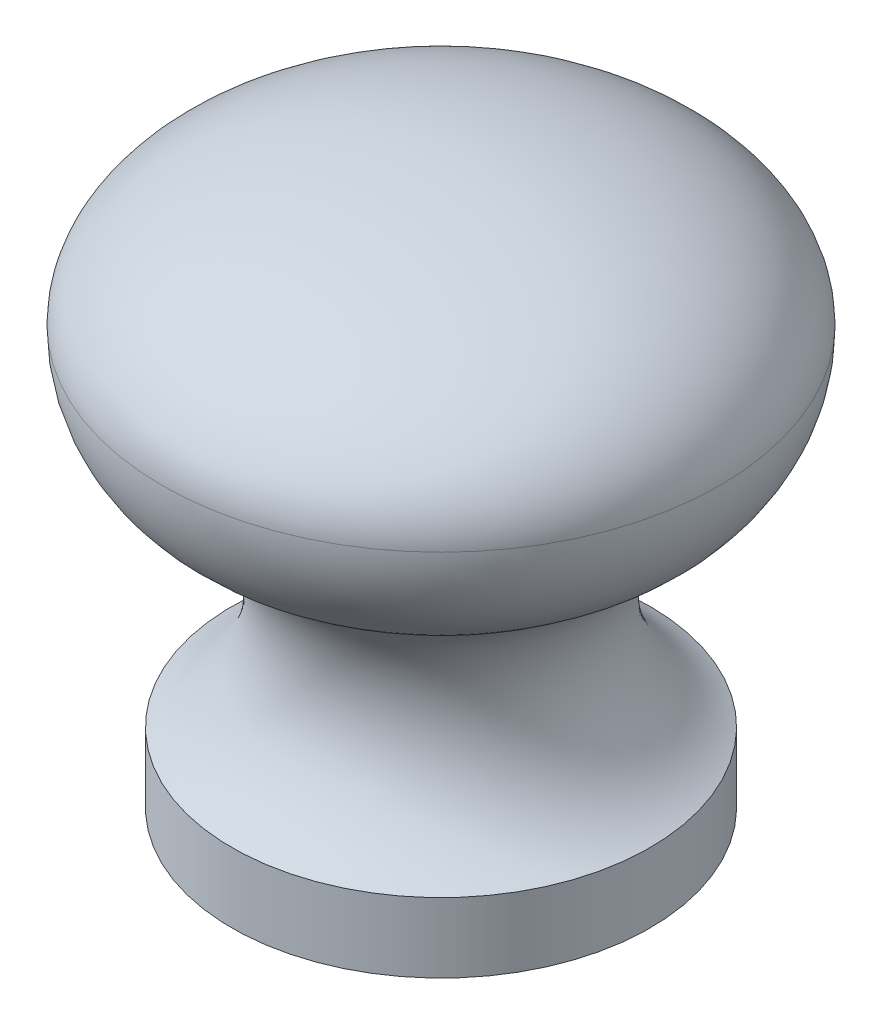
SolidWorks part; units mm, degrees
ref_plane "Front" through (0, 0, 0) normal (0, 0, 1) x (1, 0, 0)
ref_plane "Top" through (0, 0, 0) normal (0, 1, 0) x (1, 0, 0)
ref_plane "Right" through (0, 0, 0) normal (1, 0, 0) x (0, 0, -1)
other "Configuration Table"
sketch "Sketch1" plane through (0, 0, 0) normal (0, 0, 1) x (1, 0, 0)
  line L0 (0, 0) -> (0, 44.9854) construction
  line L1 (0, 0) -> (-9.525, 0)
  line L2 (-9.525, 0) -> (-9.525, 3.175)
  line L3 (0, 25.4) -> (0, 0)
  arc A0 (-9.525, 3.175) -> (-9.3873, 13.4735) centre (-12.1722, 8.3606) ccw
  arc A1 (-12.7, 19.05) -> (-9.3873, 13.4735) centre (-6.35, 19.05) ccw
  ellipse E0 centre (0, 19.05) end of major axis (-12.7, 19.05) minor radius 6.35 (0, 25.4) -> (-12.7, 19.05) ccw
  dimension "D1" = 6.35
  dimension "D2" = 25.4
  dimension "D3" = 25.4
  dimension "D7" = 6.35
  dimension "D8" = 5.8222
  dimension "D4" = 19.05
  dimension "D5" = 3.175
revolve "Base-Revolve" add sketch "Sketch1" angle 360 about L0
hole_wizard "#8-32 Tapped Hole1" positions "Sketch3" profile "Sketch2" tap size "#8-32" standard "Ansi Inch"
sketch "Sketch3" plane through (0, 0, 0) normal (0, -1, 0) x (1, 0, 0)
  circle A0 centre (0, 0) radius 9.525 construction
  point P0 (0, 0)
sketch "Sketch2" plane through (0, 0, 0) normal (1, 0, 0) x (0, 0, -1)
  line L0 (0, 0) -> (0, 16.1152)
  line L1 (0, 16.1152) -> (1.7272, 15.0774)
  line L2 (1.7272, 15.0774) -> (1.7272, 12.7)
  line L3 (1.7272, 12.7) -> (2.0828, 12.7)
  line L4 (2.0828, 12.7) -> (2.0828, 0)
  line L5 (2.0828, 0) -> (0, 0)
  line L10 (0, 16.1152) -> (-1.7272, 15.0774) construction
  line L11 (0, -6.35) -> (0, 107.95) construction
  dimension "Tap Drill Dia." = 3.4544
  dimension "Tap Drill Depth" = 15.0774
  dimension "Thread Dia." = 4.1656
  dimension "Thread Depth" = 12.7
  dimension "Drill Angle" = 118
